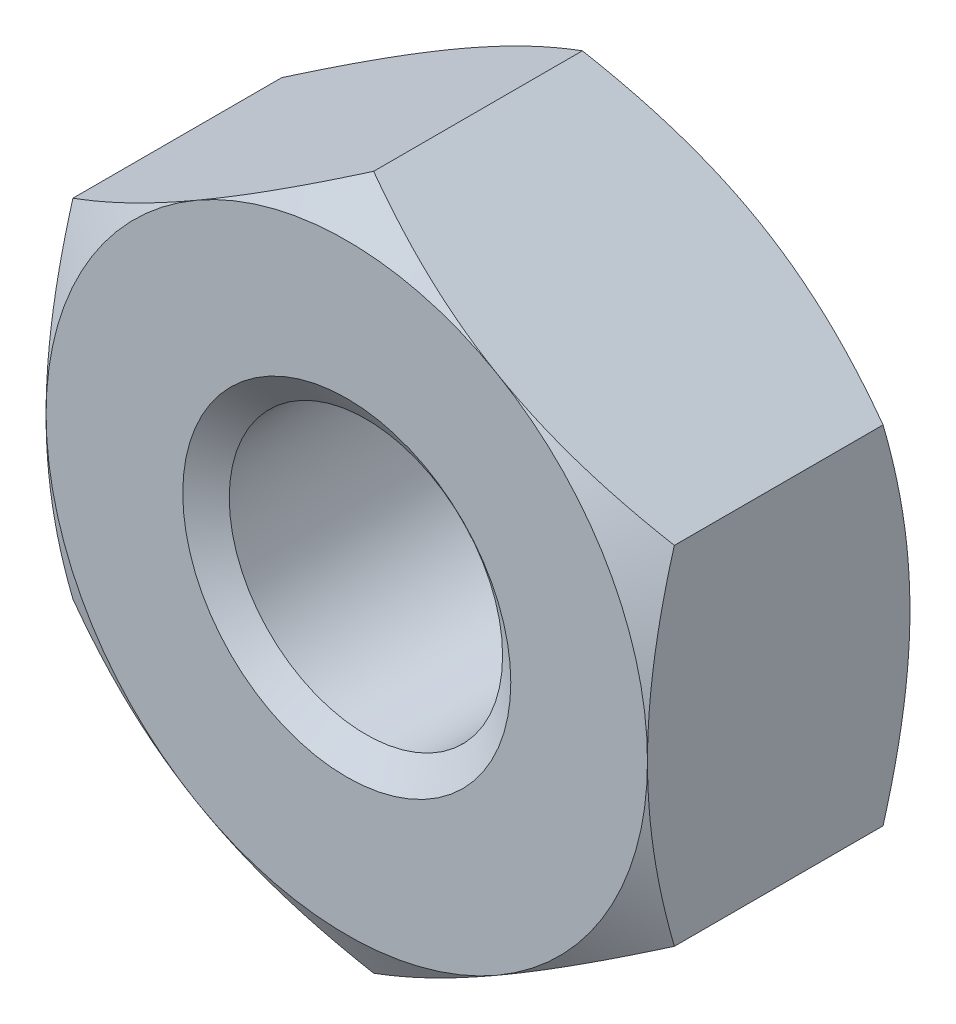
SolidWorks part; units mm, degrees
ref_plane "Plane1" through (0, 0, 0) normal (0, 0, 1) x (1, 0, 0)
ref_plane "Plane2" through (0, 0, 0) normal (0, 1, 0) x (1, 0, 0)
ref_plane "Plane3" through (0, 0, 0) normal (1, 0, 0) x (0, 0, -1)
revolve "EndChamfer" cut sketch "Sketch5"
sketch "Sketch5"
  line L0 (2.3746, 1.5) -> (2.182, 1.225)
  line L1 (2.4254, 1.5) -> (2.3746, 1.5)
  line L2 (2.4254, 1.5) -> (2.4254, 1.225)
  line L3 (2.4254, 1.225) -> (2.182, 1.225)
  line L6 (-0.0508, 1.5) -> (0, 1.5)
  line L7 (0, 1.5) -> (0.1926, 1.225)
  line L9 (0.1926, 1.225) -> (-0.0508, 1.225)
  line L10 (-0.0508, 1.225) -> (-0.0508, 1.5)
  line L11 (25.0375, 0) -> (38.388, 0) construction
  line L12 (2.4, 0) -> (0, 0) construction
extrude "BaseNut" add sketch "BaseNutSke" against normal blind 2.4
sketch "BaseNutSke" plane through (0, 0, 0) normal (0, 0, 1) x (1, 0, 0)
  line L6 (2.75, 1.5877) -> (2.75, -1.5877)
  line L7 (-2.75, 1.5877) -> (-2.75, -1.5877)
  line L8 (2.75, 1.5877) -> (0, 3.1754)
  line L9 (0, 3.1754) -> (-2.75, 1.5877)
  line L10 (-2.75, -1.5877) -> (0, -3.1754)
  line L11 (0, -3.1754) -> (2.75, -1.5877)
  circle A0 centre (0, 0) radius 1.25
  dimension "D4" = 2.75
  dimension "Tap_drill" = 2.5
  dimension "D1" = 120
  dimension "D2" = 2.75
  dimension "D3" = 2.75
  dimension "Width_flats" = 5.5
pattern_linear "ThdSchPat" [suppressed]
revolve "ThreadSchematic" cut sketch "ThdSchSke" angle 360 about L11
sketch "ThdSchSke" plane through (0, 0, 0) normal (0, 1, 0) x (1, 0, 0)
  line L0 (-1.5, 0.0254) -> (-1.25, 0.2005)
  line L1 (-1.25, 0.2005) -> (-0.625, 0.2005)
  line L2 (-0.625, 0.2005) -> (-0.625, -0.1497)
  line L3 (-0.625, -0.1497) -> (-1.25, -0.1497)
  line L4 (-1.25, -0.1497) -> (-1.5, 0.0254)
  line L5 (-3.175, 0.5) -> (3.175, 0.5) construction
  line L6 (0, 0.5) -> (0, -2.9874) construction
  line L7 (0, 2.1995) -> (0, 0.1751) construction
  dimension "D1" = 35
  dimension "VeeAngle" = 70
  dimension "SideAngle" = 55
  dimension "D2" = 0.0508
  dimension "OverCut" = 1.25
  dimension "Tap_Drill" = 2.5
  dimension "Advance" = 0.4698
  dimension "Thread_major" = 3
  dimension "Num_threads" = 6
  dimension "D4" = 50
  dimension "Offset1" = 2.4254
  dimension "ThreadMajor" = 1.5
  dimension "ChamferDepth" = 0.275
  dimension "Offset2" = 2.4762
sketch "Sketch4" plane through (0, 0, 0) normal (1, 0, 0) x (0, 0, -1)
  line L0 (2.4, 2.75) -> (2.39, 2.75)
  line L1 (2.4, 2.75) -> (2.4, 13.1754)
  line L2 (2.39, 13.1754) -> (2.4, 13.1754)
  line L3 (2.39, 13.1754) -> (2.39, 2.75)
  line L4 (0, 0) -> (34.925, 0) construction
  line L6 (2.4, 1.5877) -> (2.4, 3.1754) construction
  line L7 (0, 2.75) -> (-10, 2.75)
  line L8 (0, 1.5877) -> (0, 3.1754) construction
  line L9 (0.2456, 3.1754) -> (0.2456, 13.1754)
  line L10 (0.2456, 13.1754) -> (-10, 13.1754)
  line L11 (-10, 13.1754) -> (-10, 2.75)
  line L12 (0, 2.75) -> (0.2456, 3.1754)
  line L14 (0, 1.5877) -> (0, -1.5877) construction
  line L15 (2.4, 3.1754) -> (0, 3.1754) construction
  dimension "D1" = 2.75
  dimension "D2" = 30
  dimension "Bearing_ht" = 0.01
  dimension "D3" = 10
  dimension "D4" = 10
revolve "Bearing-Face" [suppressed] cut sketch "Sketch4" angle 360 about L4
sketch "Sketch3" plane through (0, 0, 0) normal (1, 0, 0) x (0, 0, -1)
  line L0 (2.4, 2.75) -> (2.1544, 3.1754)
  line L1 (2.1544, 3.1754) -> (2.1544, 13.1754)
  line L2 (2.1544, 13.1754) -> (12.4, 13.1754)
  line L3 (12.4, 13.1754) -> (12.4, 2.75)
  line L4 (12.4, 2.75) -> (2.4, 2.75)
  line L5 (2.4, 1.5877) -> (2.4, 3.1754) construction
  line L6 (2.4, 3.1754) -> (0, 3.1754) construction
  line L7 (0, 0) -> (38.6776, 0) construction
  line L8 (2.4, 0) -> (0, 0) construction
  line L9 (1.2, 3.1754) -> (1.2, 44.222) construction
  line L10 (0.2456, 13.1754) -> (-10, 13.1754)
  line L11 (-10, 13.1754) -> (-10, 2.75)
  line L12 (-10, 2.75) -> (0, 2.75)
  line L13 (0, 2.75) -> (0.2456, 3.1754)
  line L14 (0.2456, 3.1754) -> (0.2456, 13.1754)
  line L16 (2.4, 3.1754) -> (0, 3.1754) construction
  dimension "D1" = 2.75
  dimension "D2" = 30
  dimension "D3" = 10
  dimension "D4" = 10
revolve "Double-Chamfer" cut sketch "Sketch3" angle 360 about L7
equation "\"D2@BaseNutSke\" = \"Width_flats@BaseNutSke\" / 2"
equation "\"D3@BaseNutSke\" = \"Width_flats@BaseNutSke\" / 2"
equation "\"D1@Sketch3\" = \"Width_flats@BaseNutSke\" /2"
equation "\"D1@Sketch4\" = \"D2@BaseNutSke\""
equation "\"D4@BaseNutSke\" = \"D3@BaseNutSke\""
equation "\"Thread_major@ThdSchSke\" = \"Thread_major@ThreadCosmetic\""
equation "\"Tap_drill@ThdSchSke\" = \"Tap_drill@BaseNutSke\""
equation "\"Overcut@ThdSchSke\" = \"Tap_drill@ThdSchSke\" * 0.5"
equation "\"Num_threads@ThdSchPat\" = int(  ( \"Thickness@BaseNut\" - 0.0508 ) / \"Advance@ThdSchSke\" + 0.999 )  + 1"
equation "\"Advance@ThdSchPat\" = ( \"Thickness@BaseNut\" - 0.0508 ) /  (\"Num_threads@ThdSchPat\" - 1) 'relax it"
equation "' \"Num_threads@ThdSchPat\" = \"Num_threads@ThdSchPat\" - sgn( \"Num_threads@ThdSchPat\" - 1) '---chamfered tips only---"
equation "\"ThreadMajor@Sketch5\" = \"Thread_major@ThreadCosmetic\" * 0.5"
equation "\"ChamferDepth@Sketch5\" = (\"Thread_major@ThreadCosmetic\" - \"Tap_drill@BaseNutSke\") * 0.55"
equation "\"Offset1@Sketch5\" = \"Thickness@BaseNut\" + 0.0254"
equation "\"Offset2@Sketch5\" = \"Offset1@Sketch5\" + 0.0508"
